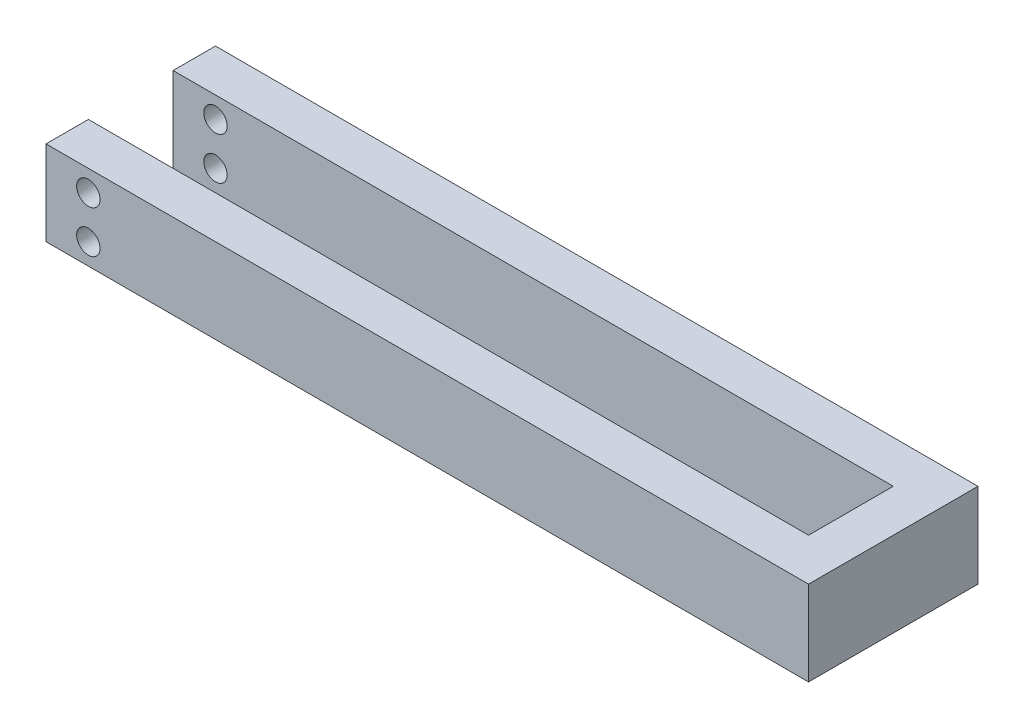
SolidWorks part; units mm, degrees
ref_plane "Front Plane" through (0, 0, 0) normal (0, 0, 1) x (1, 0, 0)
ref_plane "Top Plane" through (0, 0, 0) normal (0, 1, 0) x (1, 0, 0)
ref_plane "Right Plane" through (0, 0, 0) normal (1, 0, 0) x (0, 0, -1)
sketch "Sketch1" plane through (0, 0, 0) normal (0, 1, 0) x (1, 0, 0)
  line L0 (-44.45, 6.35) -> (-50.8, 6.35)
  line L1 (50.8, 12.7) -> (-50.8, 12.7)
  line L2 (44.45, 6.35) -> (57.15, 6.35)
  line L3 (50.8, -12.7) -> (-50.8, -12.7)
  line L4 (-50.8, 12.7) -> (-50.8, 6.35)
  line L5 (50.8, 12.7) -> (-50.8, -12.7) construction
  line L6 (50.8, -12.7) -> (-50.8, 12.7) construction
  line L7 (44.45, 6.35) -> (-44.45, 6.35)
  line L8 (44.45, -6.35) -> (57.15, -6.35)
  line L9 (44.45, -6.35) -> (-44.45, -6.35)
  line L10 (50.8, 12.7) -> (63.5, 12.7)
  line L11 (44.45, 6.35) -> (-44.45, -6.35) construction
  line L12 (44.45, -6.35) -> (-44.45, 6.35) construction
  line L13 (-44.45, -6.35) -> (-50.8, -6.35)
  line L14 (-50.8, -6.35) -> (-50.8, -12.7)
  line L15 (63.5, 12.7) -> (63.5, -12.7)
  line L16 (63.5, -12.7) -> (50.8, -12.7)
  line L17 (57.15, -6.35) -> (57.15, 6.35)
  point P0 (0, 0)
  point P5 (0, 0)
extrude "Boss-Extrude1" add sketch "Sketch1" along normal blind 12.7
sketch "Sketch2" plane through (0, 0, 12.7) normal (0, 0, 1) x (1, 0, 0)
  line L0 (-50.8, 12.7) -> (-38.1, 12.7) construction
  line L1 (-50.8, 12.7) -> (63.5, 12.7) construction
  line L2 (-38.1, 12.7) -> (-38.1, 0) construction
  line L3 (-50.8, 0) -> (63.5, 0) construction
  line L4 (-44.45, 12.7) -> (-44.45, 0) construction
  line L5 (-38.1, 6.35) -> (-50.8, 12.7) construction
  line L6 (-50.8, 12.7) -> (-50.8, 0) construction
  line L7 (-50.8, 0) -> (-38.1, 6.35) construction
  circle A0 centre (-44.45, 9.525) radius 1.7526
  circle A1 centre (-44.45, 3.175) radius 1.7526
extrude "Cut-Extrude1" cut sketch "Sketch2" against normal blind 25.4
